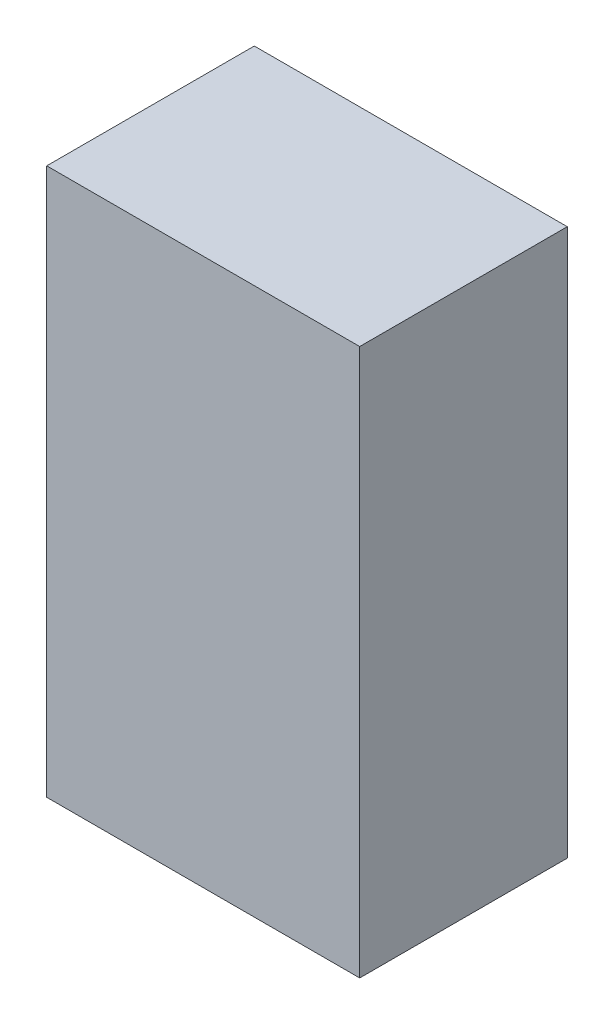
SolidWorks part; units mm, degrees
ref_plane "Plan de face" through (0, 0, 0) normal (0, 0, 1) x (1, 0, 0)
ref_plane "Plan de dessus" through (0, 0, 0) normal (0, 1, 0) x (1, 0, 0)
ref_plane "Plan de droite" through (0, 0, 0) normal (1, 0, 0) x (0, 0, -1)
sketch "Esquisse1" plane through (0, 0, 0) normal (0, 1, 0) x (1, 0, 0)
  line L1 (-47.5, 31.5) -> (47.5, 31.5)
  line L2 (-47.5, 31.5) -> (-47.5, -31.5)
  line L3 (-47.5, -31.5) -> (47.5, -31.5)
  line L4 (47.5, 31.5) -> (47.5, -31.5)
  point P4 (0, 31.5)
  point P6 (-47.5, 0)
  dimension "D1" = 95
  dimension "D2" = 63
extrude "Extrusion1" add sketch "Esquisse1" along normal blind 166
